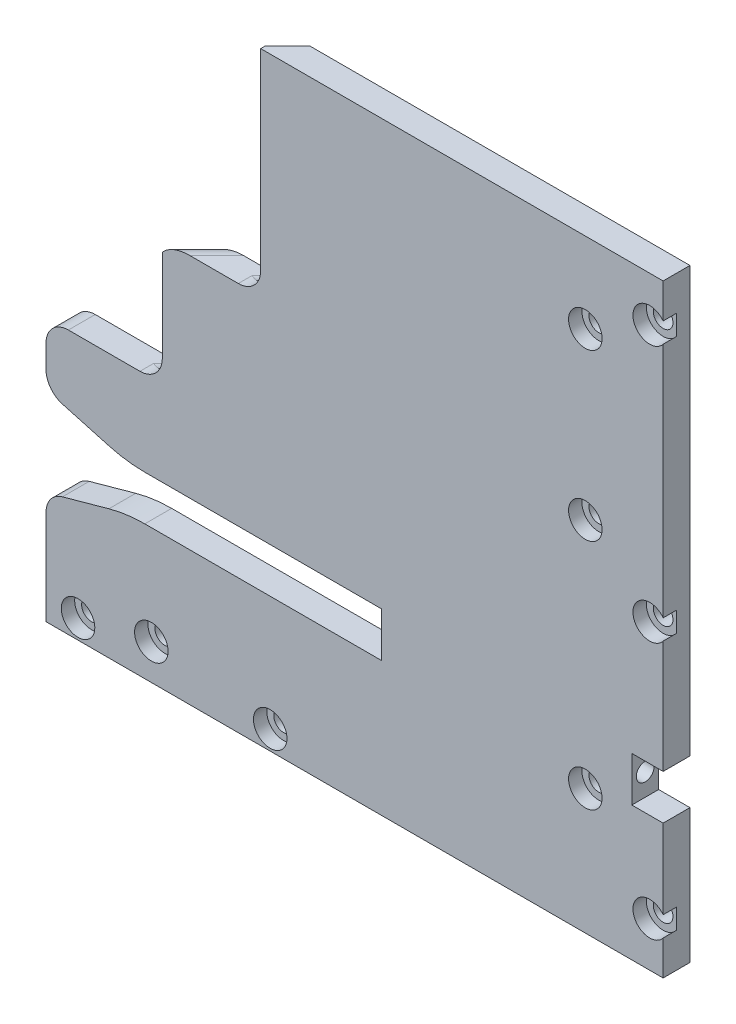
SolidWorks part; units mm, degrees
ref_plane "Front Plane" through (0, 0, 0) normal (0, 0, 1) x (1, 0, 0)
ref_plane "Top Plane" through (0, 0, 0) normal (0, 1, 0) x (1, 0, 0)
ref_plane "Right Plane" through (0, 0, 0) normal (1, 0, 0) x (0, 0, -1)
sketch "Sketch1" plane through (0, 0, 0) normal (0, 0, 1) x (1, 0, 0)
  line L0 (0, 0) -> (-138, 0)
  line L1 (-138, 0) -> (-138, 30)
  line L2 (-138, 30) -> (-63, 30)
  line L3 (-63, 30) -> (-63, 40)
  line L4 (-63, 40) -> (-138, 40)
  line L5 (-138, 40) -> (-138, 59)
  line L6 (-138, 59) -> (-112, 59)
  line L7 (-112, 59) -> (-112, 87)
  line L8 (-112, 87) -> (-90, 87)
  line L9 (-90, 87) -> (-90, 135)
  line L10 (-90, 135) -> (0, 135)
  line L11 (0, 135) -> (0, 0)
  point P10 (-120, 40)
  point P14 (-120, 30)
  dimension "D1" = 30
  dimension "D2" = 138
  dimension "D3" = 75
  dimension "D4" = 10
  dimension "D5" = 19
  dimension "D6" = 26
  dimension "D7" = 28
  dimension "D8" = 135
  dimension "D9" = 22
  dimension "D10" = 18
extrude "Boss-Extrude1" add sketch "Sketch1" along normal blind 6
sketch "Sketch4" plane through (0, 0, 0) normal (0, 0, -1) x (-1, 0, 0)
  line L0 (120, 40) -> (138, 45)
  line L1 (138, 40) -> (138, 59) construction
  line L2 (138, 45) -> (138, 40)
  line L3 (138, 40) -> (120, 40)
  line L4 (120, 30) -> (138, 30)
  line L5 (138, 30) -> (138, 25)
  line L6 (138, 0) -> (138, 30) construction
  line L7 (138, 25) -> (120, 30)
  dimension "D1" = 5
  dimension "D2" = 5
extrude "Cut-Extrude1" cut sketch "Sketch4" against normal through all
sketch "Sketch5" plane through (-63, 0, 0) normal (-1, 0, 0) x (0, 0, 1)
  line L0 (6, 30) -> (0, 30) construction
  circle A0 centre (3, 35) radius 2
  point P5 (3, 30)
  dimension "D1" = 4
extrude "Cut-Extrude2" cut sketch "Sketch5" against normal through all
fillet "Fillet1" radius 30 2 edges at (-120, 40, 3) (-120, 30, 3)
chamfer "Chamfer1" distance 5 angle 45 2 edges at (-112, 73, 0) (-90, 111, 0)
fillet "Fillet2" radius 5 3 edges at (-138, 25, 3) (-138, 45, 3) (-138, 59, 3)
sketch "Sketch6" plane through (0, 0, 6) normal (0, 0, 1) x (1, 0, 0)
  line L0 (0, 0) -> (0, 135) construction
  line L1 (0, 40) -> (-7, 40)
  line L2 (0, 40) -> (0, 30)
  line L3 (0, 30) -> (-7, 30)
  line L4 (-7, 40) -> (-7, 30)
  line L5 (-115.9107, 40) -> (-63, 40) construction
  line L6 (-63, 30) -> (-115.9107, 30) construction
  dimension "D1" = 7
extrude "Cut-Extrude3" cut sketch "Sketch6" against normal through all
sketch "Sketch7" plane through (0, 0, 6) normal (0, 0, 1) x (1, 0, 0)
  line L3 (0, 40) -> (0, 135) construction
  line L4 (0, 135) -> (-90, 135) construction
  line L5 (-138, 0) -> (0, 0) construction
  point P1 (-3, 67.5)
  point P6 (-3, 10)
  point P7 (-3, 125)
  dimension "D1" = 3
  dimension "D2" = 10
  dimension "D3" = 67.5
  dimension "D4" = 10
sketch "Sketch9" plane through (0, 0, 6) normal (0, 0, 1) x (1, 0, 0)
  point P0 (-17.4, 117)
  point P1 (-17.4, 80)
  point P3 (-17.4, 28)
hole_wizard "Hole1" positions "Sketch10" profile "Sketch11" legacy
sketch "Sketch10" plane through (0, 0, 6) normal (0, 0, 1) x (1, 0, 0)
  point P0 (-17.4, 117)
  point P3 (-17.4, 80)
  point P6 (-17.4, 28)
sketch "Sketch11" plane through (-17.4, 117, 6) normal (1, 0, 0) x (0, -1, 0)
  line L0 (0, 0) -> (0, 6)
  line L1 (0, 6) -> (2.2, 6)
  line L2 (2.2, 6) -> (2.2, 3)
  line L3 (2.2, 3) -> (3.75, 3)
  line L4 (3.75, 3) -> (3.75, 0)
  line L5 (3.75, 0) -> (0, 0)
  line L6 (0, 110) -> (0, -10) construction
  dimension "Diameter" = 4.4
  dimension "Depth" = 6
  dimension "C-Bore Diameter" = 7.5
  dimension "C-Bore Depth" = 3
hole_wizard "Hole2" positions "Sketch12" profile "Sketch13" legacy
sketch "Sketch12" plane through (0, 0, 6) normal (0, 0, 1) x (1, 0, 0)
  point P0 (-3, 125)
  point P3 (-3, 67.5)
  point P6 (-3, 10)
sketch "Sketch13" plane through (-3, 125, 6) normal (1, 0, 0) x (0, -1, 0)
  line L0 (0, 0) -> (0, 6)
  line L1 (0, 6) -> (2.2, 6)
  line L2 (2.2, 6) -> (2.2, 3)
  line L3 (2.2, 3) -> (3.75, 3)
  line L4 (3.75, 3) -> (3.75, 0)
  line L5 (3.75, 0) -> (0, 0)
  line L6 (0, 110) -> (0, -10) construction
  dimension "Diameter" = 4.4
  dimension "Depth" = 6
  dimension "C-Bore Diameter" = 7.5
  dimension "C-Bore Depth" = 3
fillet "Fillet3" radius 5 4 edges at (-112, 59, 5.5) (-109.5, 59, 2.5) (-90, 87, 5.5) (-87.5, 87, 2.5)
fillet "Fillet5" radius 5 1 edges at (-109.5, 87, 2.5)
hole_wizard "Hole3" positions "Sketch14" profile "Sketch15" legacy
sketch "Sketch14" plane through (0, 0, 6) normal (0, 0, 1) x (1, 0, 0)
  point P0 (-130.845, 4.2936)
  point P3 (-114.4514, 7.9069)
  point P6 (-87.8704, 4.2936)
sketch "Sketch15" plane through (-130.845, 4.2936, 6) normal (1, 0, 0) x (0, -1, 0)
  line L0 (0, 0) -> (0, 6)
  line L1 (0, 6) -> (2.2, 6)
  line L2 (2.2, 6) -> (2.2, 3)
  line L3 (2.2, 3) -> (3.75, 3)
  line L4 (3.75, 3) -> (3.75, 0)
  line L5 (3.75, 0) -> (0, 0)
  line L6 (0, 110) -> (0, -10) construction
  dimension "Diameter" = 4.4
  dimension "Depth" = 6
  dimension "C-Bore Diameter" = 7.5
  dimension "C-Bore Depth" = 3
